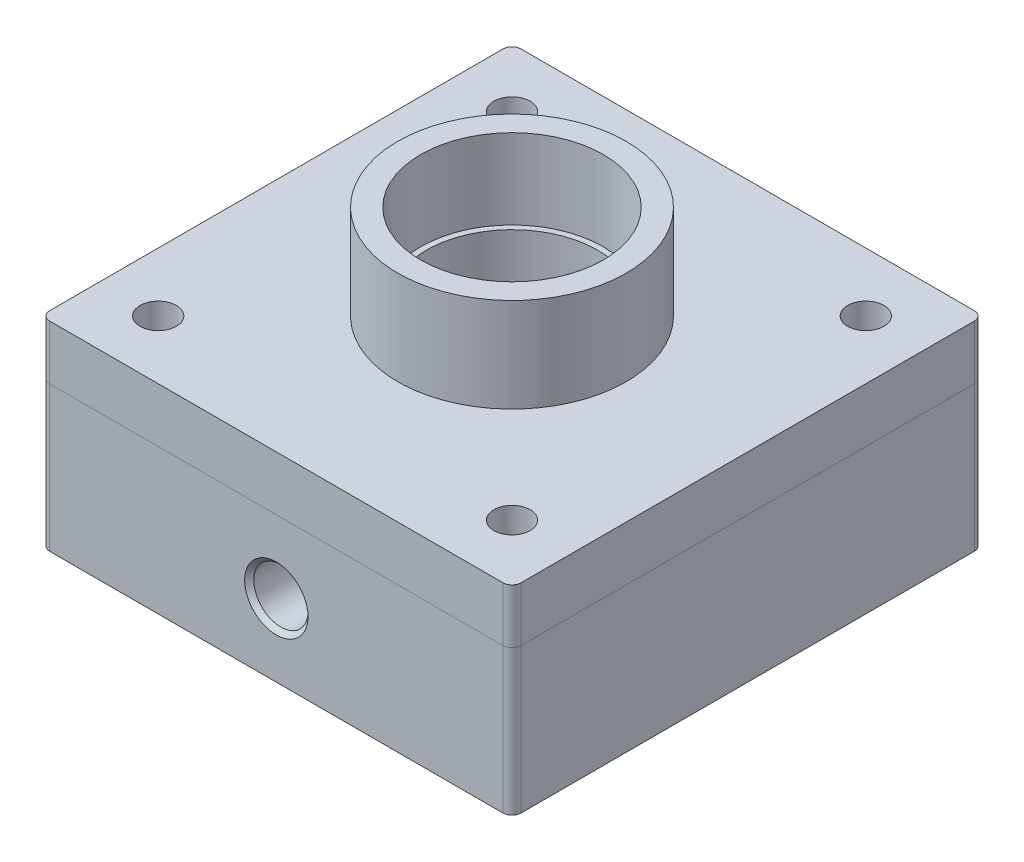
SolidWorks part; units mm, degrees
ref_plane "Front Plane" through (0, 0, 0) normal (0, 0, 1) x (1, 0, 0)
ref_plane "Top Plane" through (0, 0, 0) normal (0, 1, 0) x (1, 0, 0)
ref_plane "Right Plane" through (0, 0, 0) normal (1, 0, 0) x (0, 0, -1)
sketch "Sketch1" plane through (0, 0, 0) normal (0, 1, 0) x (1, 0, 0)
  line L1 (-82.55, 82.55) -> (82.55, 82.55)
  line L2 (-82.55, 82.55) -> (-82.55, -82.55)
  line L3 (-82.55, -82.55) -> (82.55, -82.55)
  line L4 (82.55, 82.55) -> (82.55, -82.55)
  line L5 (-82.55, 82.55) -> (82.55, -82.55) construction
  line L6 (-82.55, -82.55) -> (82.55, 82.55) construction
  point P0 (0, 0)
  dimension "D1" = 165.1
extrude "Boss-Extrude1" add sketch "Sketch1" along normal blind 50.8
sketch "Sketch2" plane through (0, 50.8, 0) normal (0, 1, 0) x (1, 0, 0)
  circle A0 centre (0, 0) radius 40
  dimension "D1" = 80
extrude "Boss-Extrude2" add sketch "Sketch2" along normal blind 52
sketch "Sketch3" plane through (0, 102.8, 0) normal (0, 1, 0) x (1, 0, 0)
  circle A0 centre (0, 0) radius 32
  dimension "D1" = 64
extrude "Cut-Extrude1" cut sketch "Sketch3" against normal blind 28
sketch "Sketch4" plane through (0, 74.8, 0) normal (0, 1, 0) x (1, 0, 0)
  circle A0 centre (0, 0) radius 30
  dimension "D1" = 60
extrude "Cut-Extrude2" cut sketch "Sketch4" against normal blind 22
fillet "Fillet1" radius 3.175 4 edges at (-82.55, 25.4, 82.55) (-82.55, 25.4, -82.55) (82.55, 25.4, -82.55) (82.55, 25.4, 82.55)
sketch "Sketch5" plane through (0, 0, 0) normal (0, -1, 0) x (1, 0, 0)
  circle A0 centre (0, 0) radius 20
  dimension "D1" = 40
extrude "Cut-Extrude3" cut sketch "Sketch5" against normal blind 40
sketch "Sketch6" plane through (0, 0, 0) normal (0, -1, 0) x (1, 0, 0)
  circle A0 centre (0, 0) radius 76.2
  circle A1 centre (0, 0) radius 69.85
  dimension "D1" = 152.4
  dimension "D2" = 139.7
extrude "Cut-Extrude4" cut sketch "Sketch6" against normal blind 8
sketch "Sketch7" plane through (0, 0, 82.55) normal (0, 0, 1) x (1, 0, 0)
  line L0 (-79.375, 25.4) -> (79.375, 25.4) construction
  line L1 (-79.375, 50.8) -> (-79.375, 0) construction
  line L2 (79.375, 0) -> (79.375, 50.8) construction
hole_wizard "1/2-14 NPSM Tapped Hole1" positions "Sketch8" profile "Sketch9" tap size "1/2-14 NPSM" standard "ANSI Inch"
sketch "Sketch8" plane through (0, 0, 82.55) normal (0, 0, 1) x (1, 0, 0)
  line L0 (-79.375, 25.4) -> (79.375, 25.4) construction
  point P0 (0, 25.4)
sketch "Sketch9" plane through (0, 25.4, 82.55) normal (1, 0, 0) x (0, -1, 0)
  line L0 (0, 0) -> (0, 52.9403)
  line L1 (0, 52.9403) -> (9.4869, 47.24)
  line L2 (9.4869, 47.24) -> (9.4869, 1.6002)
  line L3 (9.4869, 1.6002) -> (11.0871, 0)
  line L5 (11.0871, 0) -> (0, 0)
  line L6 (-9.4869, 1.6002) -> (-11.0871, 0) construction
  line L10 (0, 52.9403) -> (-9.4869, 47.24) construction
  line L11 (0, -6.35) -> (0, 107.95) construction
  dimension "Tap Drill Dia." = 18.9738
  dimension "Tap Drill Depth" = 47.24
  dimension "Near C'Sink Dia." = 22.1742
  dimension "Near C'Sink Angle" = 90
  dimension "Drill Angle" = 118
sketch "Sketch10" plane through (0, 0, 0) normal (0, -1, 0) x (1, 0, 0)
  line L0 (-79.375, 82.55) -> (79.375, 82.55) construction
  circle A0 centre (0, 50.55) radius 6.35
  dimension "D1" = 12.7
  dimension "D2" = 32
extrude "Cut-Extrude5" cut sketch "Sketch10" against normal blind 25
sketch "Sketch11" plane through (0, 0, 0) normal (0, -1, 0) x (1, 0, 0)
  line L1 (61.9638, -61.9638) -> (-61.9638, -61.9638) construction
  line L2 (61.9638, -61.9638) -> (61.9638, 61.9638) construction
  line L3 (61.9638, 61.9638) -> (-61.9638, 61.9638) construction
  line L4 (-61.9638, -61.9638) -> (-61.9638, 61.9638) construction
  line L5 (61.9638, -61.9638) -> (-61.9638, 61.9638) construction
  line L6 (61.9638, 61.9638) -> (-61.9638, -61.9638) construction
  circle A0 centre (0, 0) radius 87.63 construction
  circle A1 centre (-61.9638, 61.9638) radius 6.35
  circle A2 centre (61.9638, 61.9638) radius 6.35
  circle A3 centre (61.9638, -61.9638) radius 6.35
  circle A4 centre (-61.9638, -61.9638) radius 6.35
  dimension "D1" = 175.26
  dimension "D2" = 12.7
extrude "Cut-Extrude6" cut sketch "Sketch11" against normal through all
sketch "Sketch12" plane through (0, 50.8, 0) normal (0, 1, 0) x (1, 0, 0)
  line L4 (-82.55, 79.375) -> (-82.55, -79.375)
  line L5 (-79.375, -82.55) -> (79.375, -82.55)
  line L6 (82.55, -79.375) -> (82.55, 79.375)
  line L7 (79.375, 82.55) -> (-79.375, 82.55)
  line L8 (-82.55, 79.375) -> (-82.55, -79.375)
  line L9 (-79.375, -82.55) -> (79.375, -82.55)
  line L10 (82.55, -79.375) -> (82.55, 79.375)
  line L11 (79.375, 82.55) -> (-79.375, 82.55)
  circle A0 centre (0, 0) radius 40 construction
  circle A1 centre (61.9638, -61.9638) radius 6.35 construction
  circle A2 centre (61.9638, 61.9638) radius 6.35 construction
  circle A3 centre (-61.9638, 61.9638) radius 6.35 construction
  arc A4 (-82.55, -79.375) -> (-79.375, -82.55) centre (-79.375, -79.375) ccw
  arc A5 (79.375, -82.55) -> (82.55, -79.375) centre (79.375, -79.375) ccw
  arc A6 (82.55, 79.375) -> (79.375, 82.55) centre (79.375, 79.375) ccw
  arc A7 (-79.375, 82.55) -> (-82.55, 79.375) centre (-79.375, 79.375) ccw
  arc A8 (-82.55, -79.375) -> (-79.375, -82.55) centre (-79.375, -79.375) ccw
  arc A9 (79.375, -82.55) -> (82.55, -79.375) centre (79.375, -79.375) ccw
  arc A10 (82.55, 79.375) -> (79.375, 82.55) centre (79.375, 79.375) ccw
  arc A11 (-79.375, 82.55) -> (-82.55, 79.375) centre (-79.375, 79.375) ccw
  circle A12 centre (-61.9638, -61.9638) radius 6.35 construction
  circle A13 centre (0, 0) radius 40
  circle A14 centre (61.9638, -61.9638) radius 6.35
  circle A15 centre (61.9638, 61.9638) radius 6.35
  circle A16 centre (-61.9638, 61.9638) radius 6.35
  circle A17 centre (-61.9638, -61.9638) radius 6.35
  dimension "D1" = 0
extrude "Boss-Extrude3" add sketch "Sketch12" along normal blind 19.05 separate body
